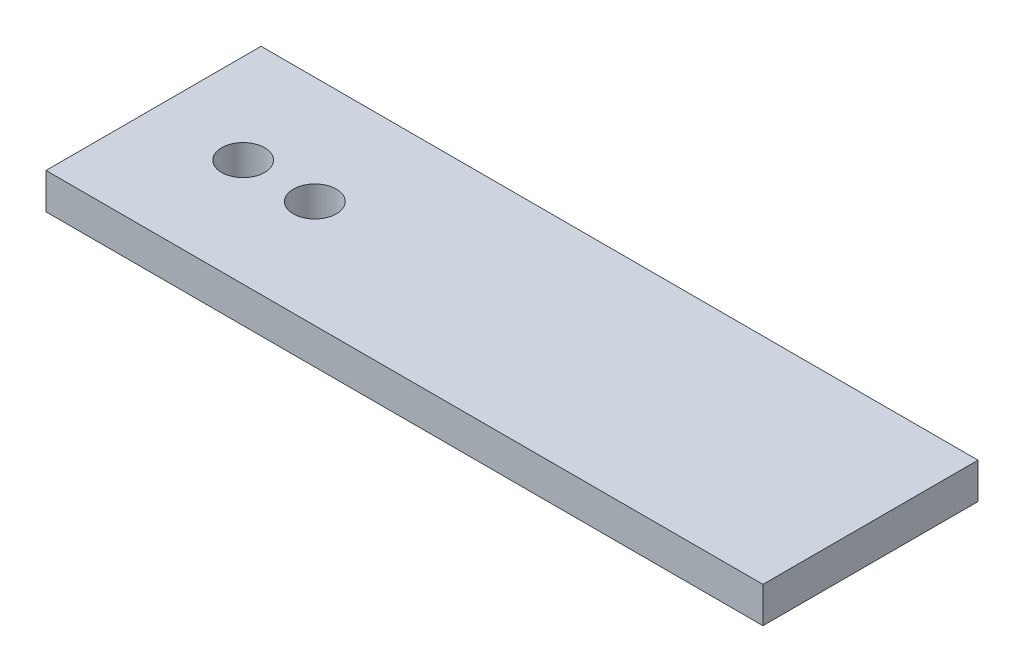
SolidWorks part; units mm, degrees
ref_plane "前视基准面" through (0, 0, 0) normal (0, 0, 1) x (1, 0, 0)
ref_plane "上视基准面" through (0, 0, 0) normal (0, 1, 0) x (1, 0, 0)
ref_plane "右视基准面" through (0, 0, 0) normal (1, 0, 0) x (0, 0, -1)
other "Configuration Table"
sketch "BaseSketch" plane through (0, 0, 0) normal (0, 1, 0) x (1, 0, 0)
  line L1 (0, 0) -> (200, 0)
  line L2 (0, 0) -> (0, 60)
  line L3 (0, 60) -> (200, 60)
  line L4 (200, 0) -> (200, 60)
extrude "BaseBoss" add sketch "BaseSketch" against normal blind 10
sketch "SeedHoleSketch" plane through (0, 0, 0) normal (0, 1, 0) x (1, 0, 0)
  circle A0 centre (25, 30) radius 6
extrude "SeedHoleCut" cut sketch "SeedHoleSketch" against normal blind 10
pattern_linear "HolesLinearPattern" count 2 spacing 20 along (1, 0, 0) of "SeedHoleCut"
